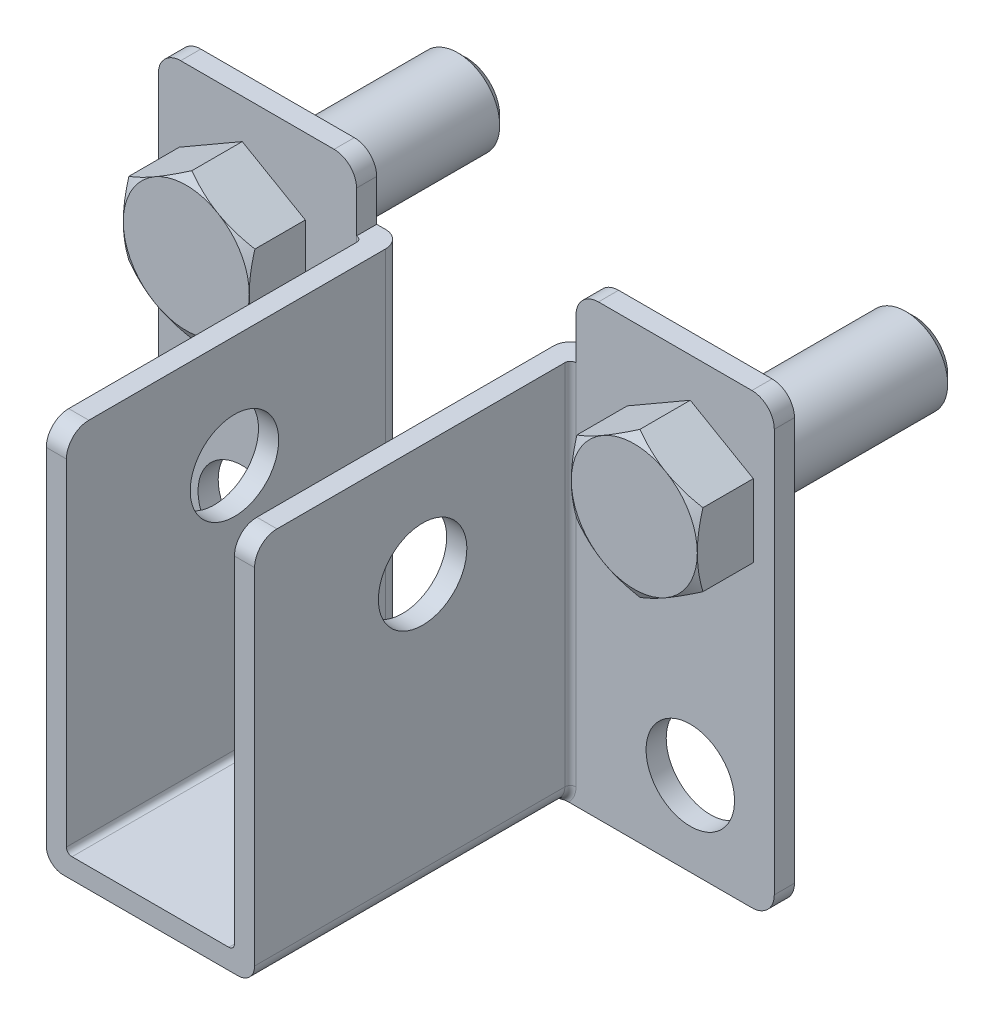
SolidWorks part; units mm, degrees
other "<3.2-1>-<Cut-Extrude3>"
other "<3.2-1>-<Cut-Extrude3>" parameters "D1"=36.4693, "D2"=1.27, "Nose Ht (Stock Check)"=38.1, "Thickness (Stock Check)"=2.286, "Hole Spacing 3 (Stock Check)"=28.575, "D3"=38.1, "Hole Spacing 4 (Stock Check)"=19.05, "Hole Size"=10.033, "Hole Spacing 1 (Stock Check)"=50.8, "Hole Spacing 2 (Stock Check)"=28.575, "D4"=11.9776, "Hole Offset (Stock Check)"=12.7
ref_plane "Front" through (0, 0, 0) normal (0, 0, 1) x (1, 0, 0)
ref_plane "Top" through (0, 0, 0) normal (0, 1, 0) x (1, 0, 0)
ref_plane "Right" through (0, 0, 0) normal (1, 0, 0) x (0, 0, -1)
sketch "Sketch1" plane through (0, 0, 0) normal (0, 0, 1) x (1, 0, 0)
  line L0 (-9.525, 0) -> (9.525, 0) construction
  line L1 (9.525, 50.8) -> (34.925, 50.8)
  line L2 (9.525, 50.8) -> (9.525, 0)
  line L3 (9.525, 0) -> (34.925, 0)
  line L4 (34.925, 50.8) -> (34.925, 0)
  line L5 (-34.925, 50.8) -> (-9.525, 50.8)
  line L6 (-34.925, 50.8) -> (-34.925, 0)
  line L7 (-34.925, 0) -> (-9.525, 0)
  line L8 (-9.525, 50.8) -> (-9.525, 0)
  dimension "Max Panel Thickness" = 19.05
  dimension "C" = 69.85
  dimension "B" = 50.8
extrude "Boss-Extrude1" add sketch "Sketch1" along normal blind 2.286
sketch "Sketch3" plane through (0, 0, 0) normal (0, 0, 1) x (1, 0, 0)
  line L0 (-9.525, 2.286) -> (9.525, 2.286)
  line L1 (-11.811, 43.561) -> (-9.525, 43.561)
  line L2 (-11.811, 43.561) -> (-11.811, 0)
  line L3 (-9.525, 0) -> (-9.525, 50.8) construction
  line L4 (-9.525, 43.561) -> (-9.525, 2.286)
  line L5 (9.525, 43.561) -> (11.811, 43.561)
  line L6 (9.525, 43.561) -> (9.525, 2.286)
  line L7 (9.525, 50.8) -> (9.525, 0) construction
  line L8 (11.811, 43.561) -> (11.811, 0)
  line L9 (0, 0) -> (0, 2.286) construction
  line L11 (-11.811, 0) -> (11.811, 0)
extrude "Boss-Extrude2" add sketch "Sketch3" along normal blind 38.1
fillet "Fillet3" radius 1.905 4 edges at (11.811, 0, 20.193) (-11.811, 0, 20.193) (9.525, 26.543, 0) (-9.525, 26.543, 0)
fillet "Fillet2" radius 0.635 8 edges at (-9.525, 2.286, 20.0025) (9.525, 2.286, 20.0025) (-11.811, 22.733, 2.286) (11.811, 22.733, 2.286) (-11.253, 0.558, 2.286) (11.253, 0.558, 2.286) (-10.083, 2.286, 0.558) (10.083, 2.286, 0.558)
sketch "Sketch5" plane through (0, 0, 0) normal (0, 0, 1) x (1, 0, 0)
  line L0 (34.925, 50.8) -> (9.525, 50.8) construction
  line L1 (-12.446, 43.561) -> (12.446, 43.561)
  line L2 (-12.446, 43.561) -> (-12.446, 50.8)
  line L3 (-12.446, 50.8) -> (12.446, 50.8)
  line L4 (12.446, 43.561) -> (12.446, 50.8)
extrude "Cut-Extrude4" cut sketch "Sketch5" along normal through all
fillet "Fillet4" radius 2.54 8 edges at (34.925, 0, 1.143) (10.668, 43.561, 38.1) (-10.668, 43.561, 38.1) (-34.925, 0, 1.143) (34.925, 50.8, 1.143) (12.446, 50.8, 1.143) (-12.446, 50.8, 1.143) (-34.925, 50.8, 1.143)
sketch "Sketch6" plane through (0, 0, 0) normal (0, 0, 1) x (1, 0, 0)
  line L0 (-14.986, 50.8) -> (-32.385, 50.8) construction
  line L1 (-25.4, 38.1) -> (25.4, 38.1) construction
  line L2 (-25.4, 38.1) -> (-25.4, 9.525) construction
  line L3 (-25.4, 9.525) -> (25.4, 9.525) construction
  line L4 (25.4, 38.1) -> (25.4, 9.525) construction
  circle A0 centre (-25.4, 38.1) radius 5.0165
  circle A1 centre (25.4, 38.1) radius 5.0165
  circle A2 centre (25.4, 9.525) radius 5.0165
  circle A3 centre (-25.4, 9.525) radius 5.0165
  point P10 (0, 38.1)
extrude "Cut-Extrude5" cut sketch "Sketch6" along normal through all
sketch "Sketch7" plane through (0, 0, 0) normal (1, 0, 0) x (0, 0, -1)
  line L0 (-1.905, 2.286) -> (-38.1, 2.286) construction
  line L1 (-38.1, 1.905) -> (-38.1, 41.021) construction
  circle A0 centre (-19.05, 30.861) radius 5.0165
extrude "Cut-Extrude6" cut sketch "Sketch7" against normal through all and the other way through all
sketch "Sketch8" plane through (0, 0, 0) normal (0, 1, 0) x (1, 0, 0)
  line L0 (11.811, -14.0335) -> (9.525, -14.0335) construction
  line L1 (-9.525, -14.0335) -> (-11.811, -14.0335) construction
  line L2 (9.525, -24.0665) -> (11.811, -24.0665) construction
  line L3 (-11.811, -24.0665) -> (-9.525, -24.0665) construction
  line L4 (11.811, -14.0335) -> (9.525, -14.0335)
  line L5 (-9.525, -14.0335) -> (-11.811, -14.0335)
  line L6 (9.525, -24.0665) -> (11.811, -24.0665)
  line L7 (-11.811, -24.0665) -> (-9.525, -24.0665)
  line L8 (-12.827, -19.05) -> (-8.509, -19.05) construction
  line L9 (9.525, -19.05) -> (11.811, -19.05) construction
  line L10 (8.509, -19.05) -> (12.827, -19.05) construction
  line L11 (9.525, -1.905) -> (9.525, -38.1) construction
  line L12 (11.811, -35.56) -> (11.811, -2.921) construction
  line L13 (-11.811, -35.56) -> (-11.811, -2.921) construction
  dimension "D1" = 1.016
  dimension "D2" = 1.016
  dimension "D3" = 1.016
sketch "Sketch9" plane through (0, 0, 0) normal (0, 0, 1) x (1, 0, 0)
  line L0 (9.525, 25.8445) -> (11.811, 25.8445) construction
  line L1 (-11.811, 25.8445) -> (-9.525, 25.8445) construction
  line L2 (-9.525, 35.8775) -> (-11.811, 35.8775) construction
  line L3 (11.811, 35.8775) -> (9.525, 35.8775) construction
  line L4 (9.525, 25.8445) -> (11.811, 25.8445)
  line L5 (-11.811, 25.8445) -> (-9.525, 25.8445)
  line L6 (-9.525, 35.8775) -> (-11.811, 35.8775)
  line L7 (11.811, 35.8775) -> (9.525, 35.8775)
  line L8 (-12.827, 30.861) -> (-8.509, 30.861) construction
  line L9 (9.525, 30.861) -> (11.811, 30.861) construction
  line L10 (8.509, 30.861) -> (12.827, 30.861) construction
inserted part "3.2-1"
move or copy body "Body-Move/Copy2" placed by mates yes
inserted part "3.2-1"
move or copy body "Body-Move/Copy4" placed by mates yes
combine bodies "Combine1" operation type add bodies to combine 115 114 116
equation "\"D1@Sketch3\" = \"Thickness (Stock Check)@Boss-Extrude1\""
equation "\"D1@Sketch7\" = \"Hole Size@Sketch6\""
